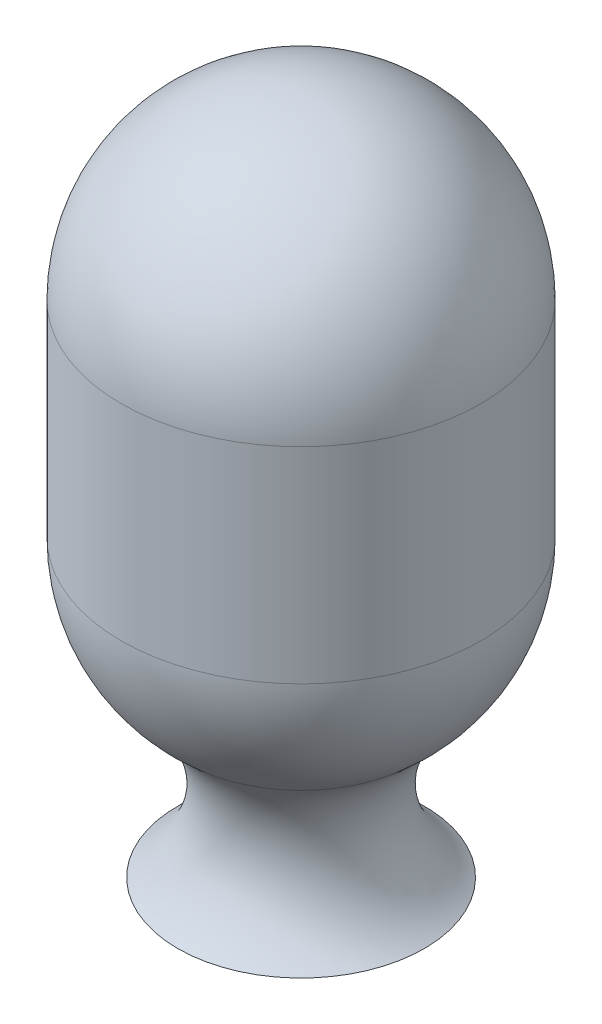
SolidWorks part; units mm, degrees
ref_plane "Front Plane" through (0, 0, 0) normal (0, 0, 1) x (1, 0, 0)
ref_plane "Top Plane" through (0, 0, 0) normal (0, 1, 0) x (1, 0, 0)
ref_plane "Right Plane" through (0, 0, 0) normal (1, 0, 0) x (0, 0, -1)
sketch "Sketch1" plane through (0, 0, 0) normal (0, 0, 1) x (1, 0, 0)
  line L0 (0, 9.9222) -> (0, 59.9222)
  line L1 (0, 59.9222) -> (18, 59.9222)
  line L2 (5.6428, -8.1614) -> (18, -8.1614)
  line L3 (18, 59.9222) -> (18, -8.1614)
  arc A0 (8.1315, 5.6858) -> (0, 9.9222) centre (0, 0) ccw
  arc A1 (8.1315, 5.6858) -> (5.6428, -8.1614) centre (0, 0) cw
  dimension "D1" = 50
  dimension "D2" = 18
revolve "Revolve1" add sketch "Sketch1" angle 360 about L3
fillet "Fillet1" radius 18 2 edges at (18, 9.9222, 18) (18, 59.9222, 18)
shell "Shell1" thickness 10
scale "Scale1" scale about centroid uniform scaling yes scale factor 0.4
